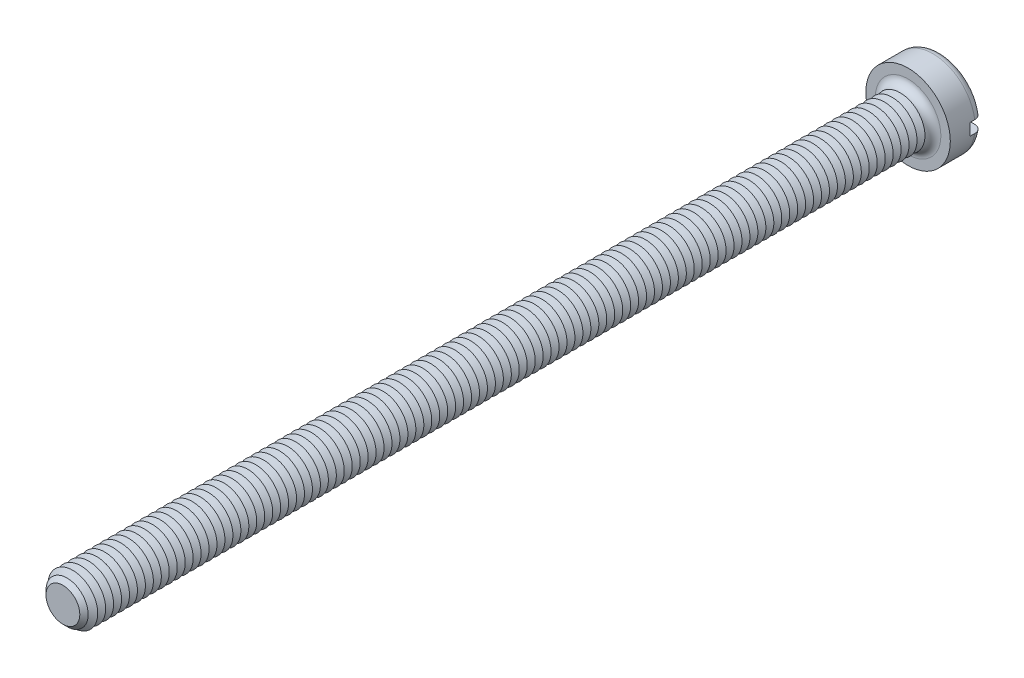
SolidWorks part; units mm, degrees
ref_plane "Front Plane" through (0, 0, 0) normal (0, 0, 1) x (1, 0, 0)
ref_plane "Top Plane" through (0, 0, 0) normal (0, 1, 0) x (1, 0, 0)
ref_plane "Right Plane" through (0, 0, 0) normal (1, 0, 0) x (0, 0, -1)
sketch "Sketch3" plane through (0, 0, 0) normal (0, 0, 1) x (1, 0, 0)
  circle A0 centre (0, 0) radius 4.25
  dimension "D1" = 8.5
extrude "Boss-Extrude2" add sketch "Sketch3" against normal blind 3.3
sketch "Sketch4" plane through (0, 0, 0) normal (0, 0, 1) x (1, 0, 0)
  circle A0 centre (0, 0) radius 2.5
  dimension "D1" = 5
extrude "Boss-Extrude3" add sketch "Sketch4" along normal blind 85
fillet "Fillet1" radius 0.8 2 edges at (4.25, 0, -3.3) (2.5, 0, 0)
chamfer "Chamfer1" distance 0.8 angle 45 1 edges at (2.5, 0, 85)
sketch "Sketch5" plane through (0, 0, 0) normal (1, 0, 0) x (0, 0, -1)
  line L0 (1.6944, 0) -> (-7.6738, 0) construction
sketch "Sketch6" plane through (0, 0, 0) normal (1, 0, 0) x (0, 0, -1)
  line L0 (-0.8, 2.5) -> (-1.2, 1.8072)
  line L1 (-1.2, 1.8072) -> (-1.6, 2.5)
  line L2 (-0.8, 2.5) -> (-84.2, 2.5) construction
  line L3 (-1.6, 2.5) -> (-0.8, 2.5)
  dimension "D1" = 0.8
revolve "Cut-Revolve1" cut sketch "Sketch6" angle 360 about L0
pattern_linear "LPattern1" count 105 spacing 0.8 along (0, 0, 1) of "Cut-Revolve1"
sketch "Sketch8" plane through (0, 0, -3.3) normal (0, 0, -1) x (-1, 0, 0)
  line L1 (4.25, -0.6) -> (-4.25, -0.6)
  line L2 (4.25, -0.6) -> (4.25, 0.6)
  line L3 (4.25, 0.6) -> (-4.25, 0.6)
  line L4 (-4.25, -0.6) -> (-4.25, 0.6)
  line L5 (4.25, -0.6) -> (-4.25, 0.6) construction
  line L6 (4.25, 0.6) -> (-4.25, -0.6) construction
  point P0 (0, 0)
  dimension "D1" = 8.5
  dimension "D2" = 1.2
extrude "Cut-Extrude1" cut sketch "Sketch8" against normal blind 1.3
